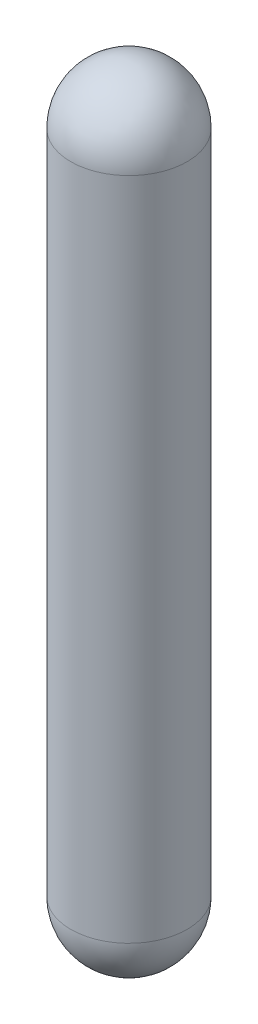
SolidWorks part; units mm, degrees
ref_plane "Front Plane" through (0, 0, 0) normal (0, 0, 1) x (1, 0, 0)
ref_plane "Top Plane" through (0, 0, 0) normal (0, 1, 0) x (1, 0, 0)
ref_plane "Right Plane" through (0, 0, 0) normal (1, 0, 0) x (0, 0, -1)
sketch "Sketch1" plane through (0, 0, 0) normal (0, 1, 0) x (1, 0, 0)
  circle A0 centre (0, 0) radius 2.2225
  dimension "D1" = 4.445
extrude "Boss-Extrude1" add sketch "Sketch1" along normal blind 25.4
sketch "Sketch2" plane through (0, 25.4, 0) normal (0, 1, 0) x (1, 0, 0)
  line L0 (-2.2225, 0) -> (2.2225, 0)
  arc A0 (2.2225, 0) -> (-2.2225, 0) centre (0, 0) ccw
  circle A1 centre (0, 0) radius 2.2225 construction
revolve "Revolve1" add sketch "Sketch2" angle 180 about L0
sketch "Sketch3" plane through (0, 0, 0) normal (0, -1, 0) x (-1, 0, 0)
  line L0 (-2.2225, 0) -> (2.2225, 0)
  arc A0 (2.2225, 0) -> (-2.2225, 0) centre (0, 0) ccw
  circle A2 centre (0, 0) radius 2.2225 construction
revolve "Revolve2" add sketch "Sketch3" angle 180 about L0
